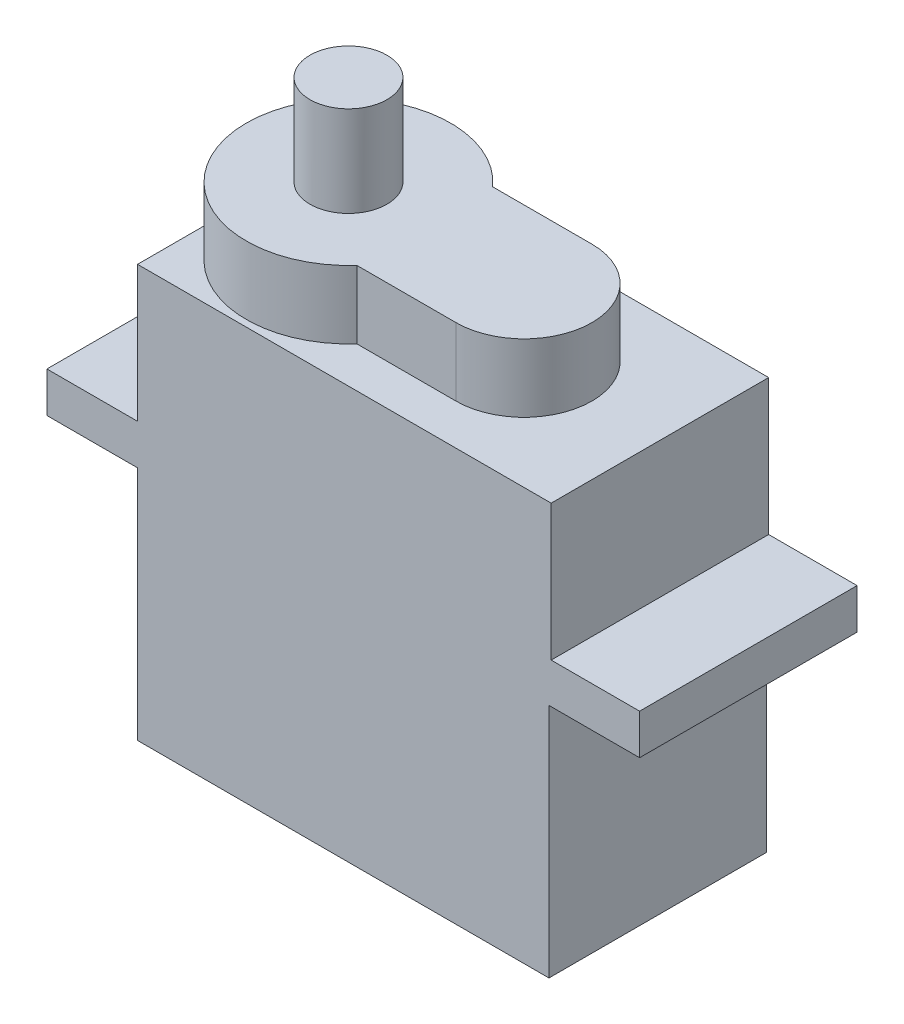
SolidWorks part; units mm, degrees
ref_plane "Front Plane" through (0, 0, 0) normal (0, 0, 1) x (1, 0, 0)
ref_plane "Top Plane" through (0, 0, 0) normal (0, 1, 0) x (1, 0, 0)
ref_plane "Right Plane" through (0, 0, 0) normal (1, 0, 0) x (0, 0, -1)
sketch "Sketch1" plane through (0, 0, 0) normal (0, 0, 1) x (1, 0, 0)
  line L0 (-11.5316, 9.8806) -> (11.6547, 9.8806)
  line L1 (11.6547, 9.8806) -> (11.6547, 2.2606)
  line L2 (11.6547, 2.2606) -> (16.6116, 2.2606)
  line L3 (16.6116, 2.2606) -> (16.6116, 0)
  line L4 (16.6116, 0) -> (11.5316, 0)
  line L5 (11.5316, 0) -> (11.5316, -13.2334)
  line L6 (11.5316, -13.2334) -> (-11.5316, -13.2334)
  line L7 (-11.5316, -13.2334) -> (-11.5316, 0)
  line L8 (-11.5316, 0) -> (-16.6116, 0)
  line L9 (-16.6116, 0) -> (-16.6116, 2.2606)
  line L10 (-16.6116, 2.2606) -> (-11.5316, 2.2606)
  line L11 (-11.5316, 2.2606) -> (-11.5316, 9.8806)
  point P12 (0, -13.2334)
  dimension "D1" = 23.0632
  dimension "D2" = 2.2606
  dimension "D3" = 2.2606
  dimension "D4" = 23.114
  dimension "D5" = 7.62
  dimension "D6" = 7.62
  dimension "D7" = 5.08
  dimension "D8" = 5.08
  dimension "D9" = 23.1863
extrude "Boss-Extrude1" add sketch "Sketch1" along normal blind 12.192
sketch "Sketch2" plane through (0, 9.8806, 0) normal (0, 1, 0) x (1, 0, 0)
  line L0 (-11.5316, -12.192) -> (-11.5316, 0) construction
  line L1 (11.6547, -12.192) -> (11.6547, 0) construction
  line L2 (4.0347, -2.286) -> (-1.5272, -2.286)
  line L3 (4.0347, -9.906) -> (-1.5272, -9.906)
  circle A0 centre (-5.8039, -6.096) radius 5.7277 construction
  circle A1 centre (4.0347, -6.096) radius 3.81 construction
  arc A2 (4.0347, -2.286) -> (4.0347, -9.906) centre (4.0347, -6.096) cw
  arc A3 (-1.5272, -2.286) -> (-1.5272, -9.906) centre (-5.8039, -6.096) ccw
  point P8 (11.6547, -6.096)
  dimension "D1" = 11.4554
  dimension "D2" = 7.62
  dimension "D3" = 7.62
extrude "Boss-Extrude2" add sketch "Sketch2" along normal blind 3.81
sketch "Sketch3" plane through (0, 13.6906, 0) normal (0, 1, 0) x (1, 0, 0)
  circle A0 centre (-5.8039, -6.096) radius 2.159
  dimension "D1" = 4.318
extrude "Boss-Extrude3" add sketch "Sketch3" along normal blind 5.08
